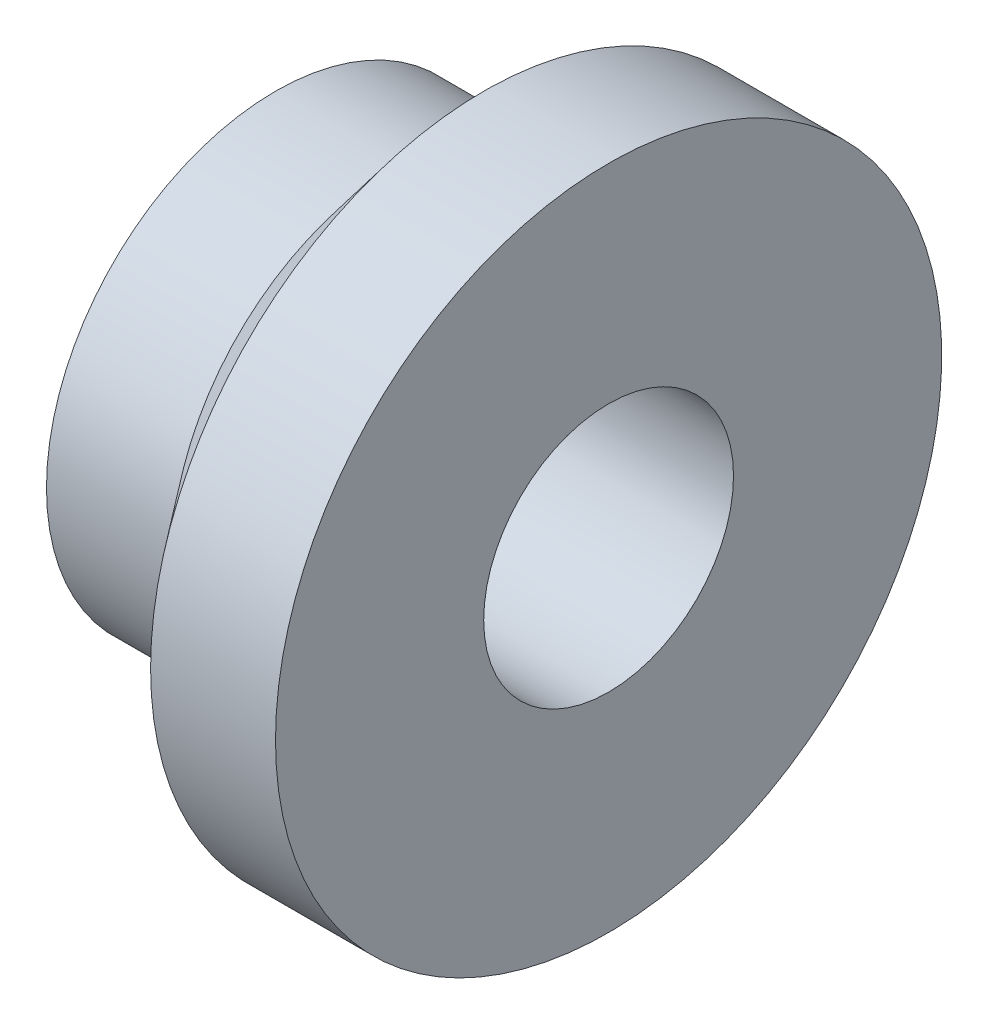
SolidWorks part; units mm, degrees
ref_plane "Plan de face" through (0, 0, 0) normal (0, 0, 1) x (1, 0, 0)
ref_plane "Plan de dessus" through (0, 0, 0) normal (0, 1, 0) x (1, 0, 0)
ref_plane "Plan de droite" through (0, 0, 0) normal (1, 0, 0) x (0, 0, -1)
sketch "Esquisse1" plane through (0, 0, 0) normal (0, 0, 1) x (1, 0, 0)
  line L0 (0, 1.5) -> (4, 1.5)
  line L1 (4, 1.5) -> (4, 4)
  line L2 (4, 4) -> (2.5, 4)
  line L3 (2.5, 4) -> (1.5, 2.75)
  line L4 (1.5, 2.75) -> (0, 2.75)
  line L5 (0, 2.75) -> (0, 1.5)
  line L6 (0, 0) -> (4, 0) construction
  dimension "D1" = 3
  dimension "D2" = 8
  dimension "D3" = 5.5
  dimension "D4" = 4
  dimension "D5" = 1.5
  dimension "D6" = 1.5
revolve "Révolution1" add sketch "Esquisse1" angle 360 about L6
